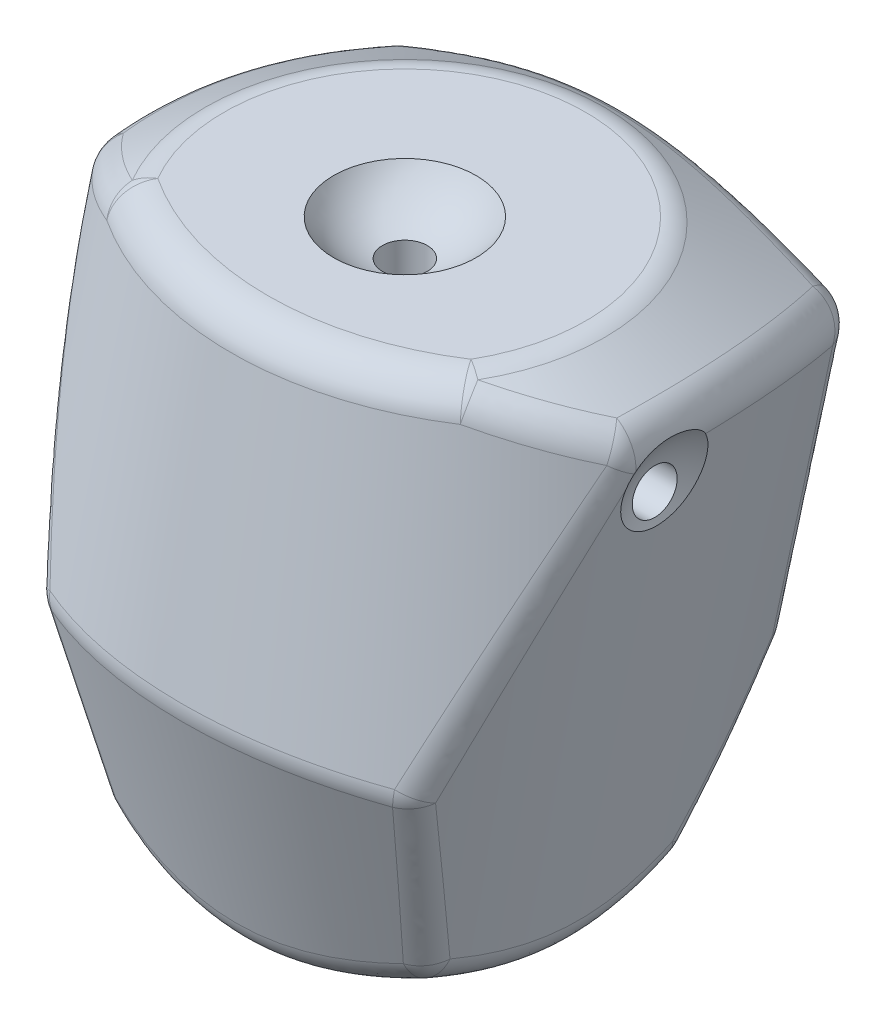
SolidWorks part; units mm, degrees
ref_plane "Plan de face" through (0, 0, 0) normal (0, 0, 1) x (1, 0, 0)
ref_plane "Plan de dessus" through (0, 0, 0) normal (0, 1, 0) x (1, 0, 0)
ref_plane "Plan de droite" through (0, 0, 0) normal (1, 0, 0) x (0, 0, -1)
sketch "Esquisse1" plane through (0, 0, 0) normal (0, 0, 1) x (1, 0, 0)
  line L0 (0, 75.941) -> (0, -64.532) construction
  line L1 (150, 330) -> (-150, 330)
  line L2 (-150, 330) -> (-90, 36)
  line L3 (-90, 36) -> (90, 36)
  line L4 (150, 330) -> (90, 36)
  point P8 (0, 36)
  point P9 (0, 330)
  dimension "D1" = 294
  dimension "D2" = 180
  dimension "D3" = 300
  dimension "D4" = 36
extrude "Extrusion1" add sketch "Esquisse1" along normal mid plane 240
sketch "Esquisse2" plane through (0, 0, 0) normal (0, 0, 1) x (1, 0, 0)
  line L0 (0, 0) -> (0, 365.1564) construction
  line L1 (102, 330) -> (202, 272.265)
  line L2 (102, 330) -> (202, 330)
  line L3 (202, 272.265) -> (202, 330)
  line L4 (150, 330) -> (-150, 330) construction
  dimension "D1" = 60
  dimension "D2" = 102
  dimension "D3" = 100
revolve "Enlèvement de matière-Révolution1" cut sketch "Esquisse2" angle 360 about L0
sketch "Esquisse3" plane through (0, 0, 0) normal (1, 0, 0) x (0, 0, -1)
  line L0 (80, 0) -> (80, 364.1402) construction
  line L1 (-90, 330) -> (-351.4881, -1152.9725)
  line L2 (-351.4881, -1152.9725) -> (-351.4881, 330)
  line L3 (-351.4881, 330) -> (-90, 330)
  line L4 (102, 330) -> (-102, 330) construction
  dimension "D1" = 10
  dimension "D2" = 170
  dimension "D3" = 80
revolve "Enlèvement de matière-Révolution3" cut sketch "Esquisse3" angle 360 about L0
sketch "Esquisse4" plane through (0, 0, 0) normal (0, 0, 1) x (1, 0, 0)
  line L0 (200, 0) -> (200, 360.6689) construction
  line L1 (-144.8323, 304.6783) -> (-91.974, 45.6728) construction
  line L2 (-181.4375, 484.044) -> (-80.4381, -10.8532)
  line L3 (-181.4375, 484.044) -> (-181.4375, -10.8532)
  line L4 (-181.4375, -10.8532) -> (-80.4381, -10.8532)
  dimension "D1" = 200
revolve "Enlèvement de matière-Révolution4" cut sketch "Esquisse4" angle 360 about L0
mirror "Symétrie1" about plane through (0, 0, 0) normal (1, 0, 0) of "Enlèvement de matière-Révolution4"
sketch "Esquisse5" plane through (0, 0, 0) normal (1, 0, 0) x (0, 0, -1)
  line L0 (100, 20.1517) -> (100, 257.9458) construction
  line L1 (-177.9303, 376.0604) -> (-70, -26.741)
  line L2 (-70, -26.741) -> (-177.9303, -26.741)
  line L3 (-177.9303, -26.741) -> (-177.9303, 376.0604)
  dimension "D1" = 100
  dimension "D2" = 15
  dimension "D3" = 170
revolve "Enlèvement de matière-Révolution5" cut sketch "Esquisse5" angle 360 about L0
sketch "Esquisse6" plane through (0, 0, 0) normal (1, 0, 0) x (0, 0, -1)
  line L0 (-15, 0) -> (-15, 358.551) construction
  line L1 (65, -4) -> (263.4328, 339.6957)
  line L2 (263.4328, 339.6957) -> (263.4328, -4)
  line L3 (263.4328, -4) -> (65, -4)
  line L4 (-67.8801, 36) -> (120, 36) construction
  dimension "D1" = 15
  dimension "D2" = 80
  dimension "D3" = 30
  dimension "D4" = 40
revolve "Enlèvement de matière-Révolution6" cut sketch "Esquisse6" angle 360 about L0
sketch "Esquisse7" plane through (0, 36, 0) normal (0, -1, 0) x (1, 0, 0)
  circle A0 centre (0, 0) radius 81
  dimension "D1" = 162
extrude "Enlèv. mat.-Extru.1" cut sketch "Esquisse7" against normal through all draft 57 flip side to cut
fillet "Congé1" radius 20 21 edges at (6.1418, 91.5047, -120) (-91.2229, 43.1102, 11.5306) (-129.823, 296.1775, -94.5129) (-114.844, 316.9249, 48.4524) (-22.991, 318.3476, -120) (143.2676, 304.1724, -31.7089) (100.2403, 321.7033, 59.1093) (89.4535, 47.1846, 40.5682) (-20.2672, 41.5363, 87.2009) (-21.125, 159.6327, 118.9218) (-2.4879, 43.3752, -92.3232) (0, 330, -102) (0, 330, 90)
sketch "Esquisse8" plane through (0, 36, 0) normal (0, -1, 0) x (1, 0, 0)
  circle A0 centre (0, 0) radius 12
  dimension "D1" = 24
extrude "Enlèv. mat.-Extru.2" cut sketch "Esquisse8" against normal through all
sketch "Esquisse9" plane through (0, 0, 0) normal (0, 0, 1) x (1, 0, 0)
  line L0 (0, 0) -> (0, 361.4504) construction
  line L1 (83.6756, 330) -> (-83.6756, 330) construction
  line L2 (0, 309) -> (0, 399)
  arc A0 (0, 399) -> (0, 309) centre (0, 354) ccw
  dimension "D1" = 90
  dimension "D2" = 24
revolve "Enlèvement de matière-Révolution7" cut sketch "Esquisse9" angle 360 about L0
sketch "Esquisse10" plane through (0, 0, 0) normal (0, 0, 1) x (1, 0, 0)
  line L0 (0, 0) -> (0, 367.2942) construction
  line L1 (-81, 36) -> (81, 36) construction
  line L2 (0, 75) -> (0, -75)
  arc A0 (0, -75) -> (0, 75) centre (0, 0) ccw
  dimension "D1" = 150
  dimension "D2" = 36
revolve "Enlèvement de matière-Révolution8" cut sketch "Esquisse10" angle 360 about L0
sketch "Esquisse11" plane through (0, 0, 0) normal (1, 0, 0) x (0, 0, -1)
  circle A0 centre (0, 269.5439) radius 12
  dimension "D1" = 24
extrude "Enlèv. mat.-Extru.3" cut sketch "Esquisse11" against normal through all and the other way through all
sketch "Esquisse12" plane through (0, 0, 0) normal (0, 0, 1) x (1, 0, 0)
  line L0 (103.8727, 269.5439) -> (256.1273, 269.5439) construction
  line L1 (132, 269.5439) -> (228, 269.5439)
  line L2 (140.111, 281.5439) -> (12, 281.5439) construction
  arc A0 (228, 269.5439) -> (132, 269.5439) centre (180, 269.5439) ccw
  dimension "D1" = 96
  dimension "D3" = 180
  dimension "D2" = 12
revolve "Enlèvement de matière-Révolution9" cut sketch "Esquisse12" angle 360 about L0
mirror "Symétrie2" about plane through (0, 0, 0) normal (1, 0, 0) of "Enlèvement de matière-Révolution9"
sketch "Esquisse13" plane through (0, 0, 0) normal (1, 0, 0) x (0, 0, -1)
  line L0 (70, 342.456) -> (70, 174.8939) construction
  line L1 (70, 324.5439) -> (70, 214.5439)
  line L2 (0, 0) -> (0, 361.4504) construction
  arc A0 (70, 214.5439) -> (70, 324.5439) centre (70, 269.5439) ccw
  dimension "D2" = 55
  dimension "D1" = 70
revolve "Révolution1" add sketch "Esquisse13" angle 360 about L0
